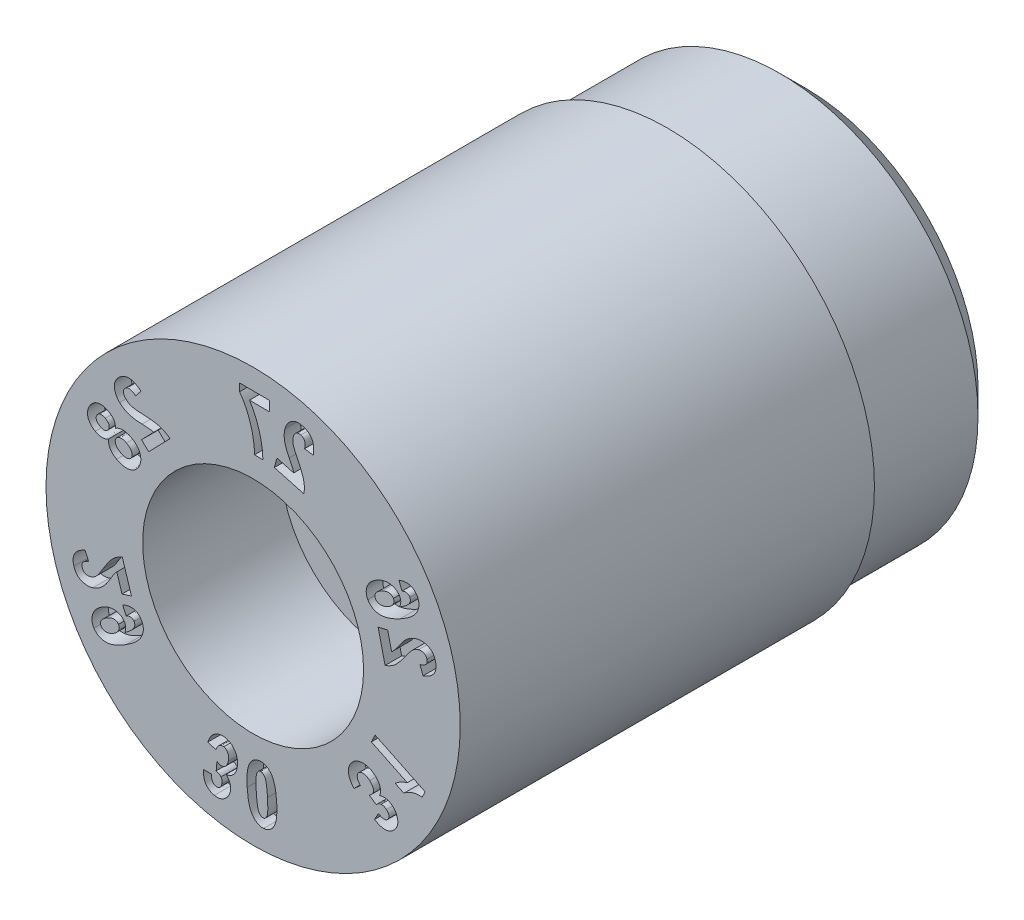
SolidWorks part; units mm, degrees
ref_plane "Front Plane" through (0, 0, 0) normal (0, 0, 1) x (1, 0, 0)
ref_plane "Top Plane" through (0, 0, 0) normal (0, 1, 0) x (1, 0, 0)
ref_plane "Right Plane" through (0, 0, 0) normal (1, 0, 0) x (0, 0, -1)
sketch "Sketch1" plane through (0, 0, 0) normal (1, 0, 0) x (0, 0, -1)
  line L2 (0, 1.5) -> (0, 0.8)
  line L3 (3.75, 1.5) -> (0, 1.5)
  line L4 (-3.7979, 0) -> (49996.2021, 0) construction
  line L8 (4, 0.5) -> (1, 0.5)
  line L9 (1, 0.8) -> (1, 0.5)
  line L10 (1, 0.8) -> (0, 0.8)
  line L12 (4, 0.5) -> (4, 1.25)
  line L16 (4, 1.25) -> (3.75, 1.5)
  dimension "D1" = 4
  dimension "D2" = 45
  dimension "D3" = 0.25
  dimension "D4" = 3
  dimension "D5" = 1.6
  dimension "D6" = 1
  dimension "D7" = 1
revolve "Revolve1" add sketch "Sketch1" angle 360 about L4
sketch "Sketch5" plane through (0, 0, 0) normal (1, 0, 0) x (0, 0, -1)
  line L0 (0, 0) -> (50000, 0) construction
  line L1 (0, 1.5) -> (0, -1.5) construction
  line L2 (3, 1.435) -> (4, 1.435)
  line L3 (3, 1.435) -> (3, 2.435)
  line L4 (3, 2.435) -> (4, 2.435)
  line L5 (4, 1.435) -> (4, 2.435)
  line L6 (4, -1.25) -> (4, 1.25) construction
  line L7 (3.75, 1.5) -> (0, 1.5) construction
  dimension "D1" = 3
  dimension "D2" = 0.065
  dimension "D3" = 1
revolve "Cut-Revolve1" cut sketch "Sketch5" angle 360 about L0
sketch "Sketch12" plane through (0, 0, 0) normal (0, 0, 1) x (1, 0, 0)
  arc A0 (0.9586, 0.0955) -> (0.9603, -0.077) centre (0, 0) ccw construction
  text T0 "26    27    28    29    30    31" font "Arial Narrow" height 0.4
extrude "Cut-Extrude3" cut sketch "Sketch12" against normal blind 0.12
